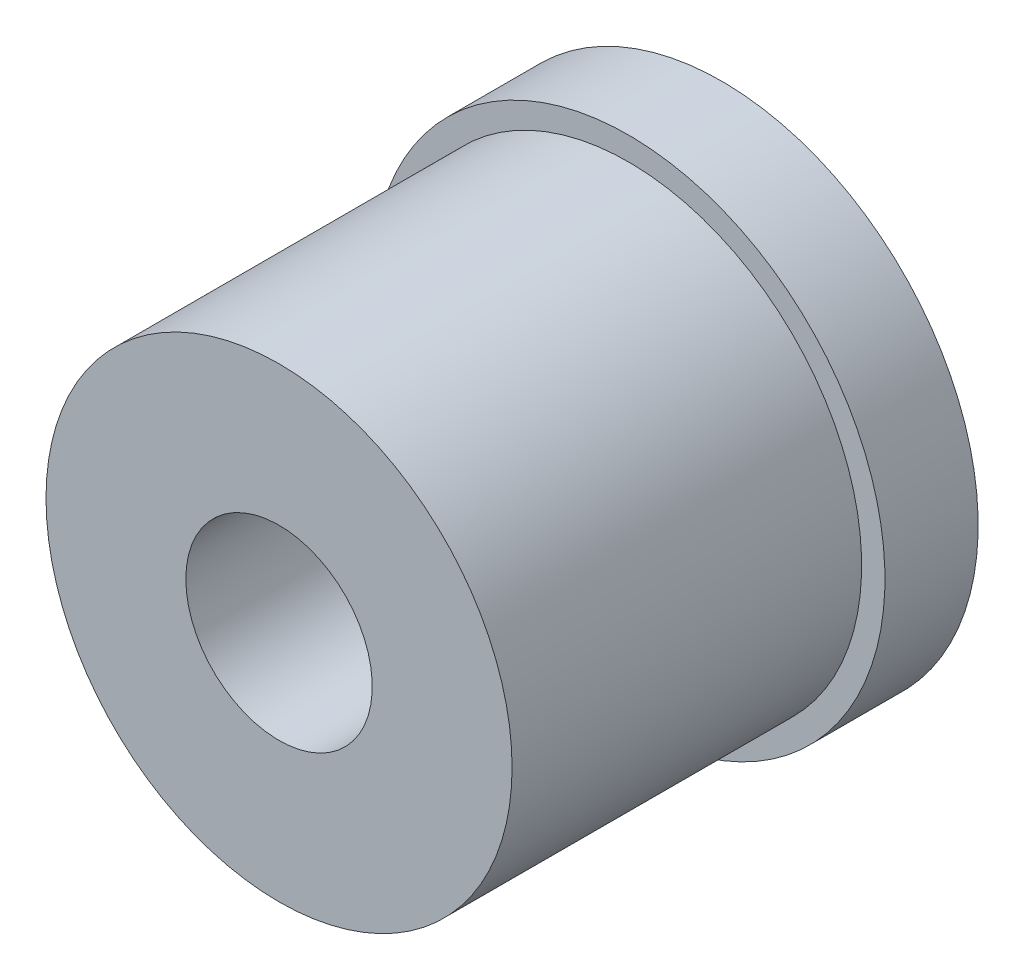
SolidWorks part; units mm, degrees
ref_plane "Plan de face" through (0, 0, 0) normal (0, 0, 1) x (1, 0, 0)
ref_plane "Plan de dessus" through (0, 0, 0) normal (0, 1, 0) x (1, 0, 0)
ref_plane "Plan de droite" through (0, 0, 0) normal (1, 0, 0) x (0, 0, -1)
sketch "Esquisse1" plane through (0, 0, 0) normal (0, 0, 1) x (1, 0, 0)
  circle A0 centre (0, 0) radius 2.5
  dimension "D1" = 5
extrude "Extrusion1" add sketch "Esquisse1" along normal blind 3.75
sketch "Esquisse2" plane through (0, 0, 0) normal (0, 0, -1) x (-1, 0, 0)
  circle A0 centre (0, 0) radius 2.75
  dimension "D1" = 5.5
extrude "Extrusion2" add sketch "Esquisse2" along normal blind 1
sketch "Esquisse3" plane through (0, 0, -1) normal (0, 0, -1) x (-1, 0, 0)
  circle A0 centre (0, 0) radius 1
  dimension "D1" = 2
extrude "Enlèv. mat.-Extru.1" cut sketch "Esquisse3" against normal through all
